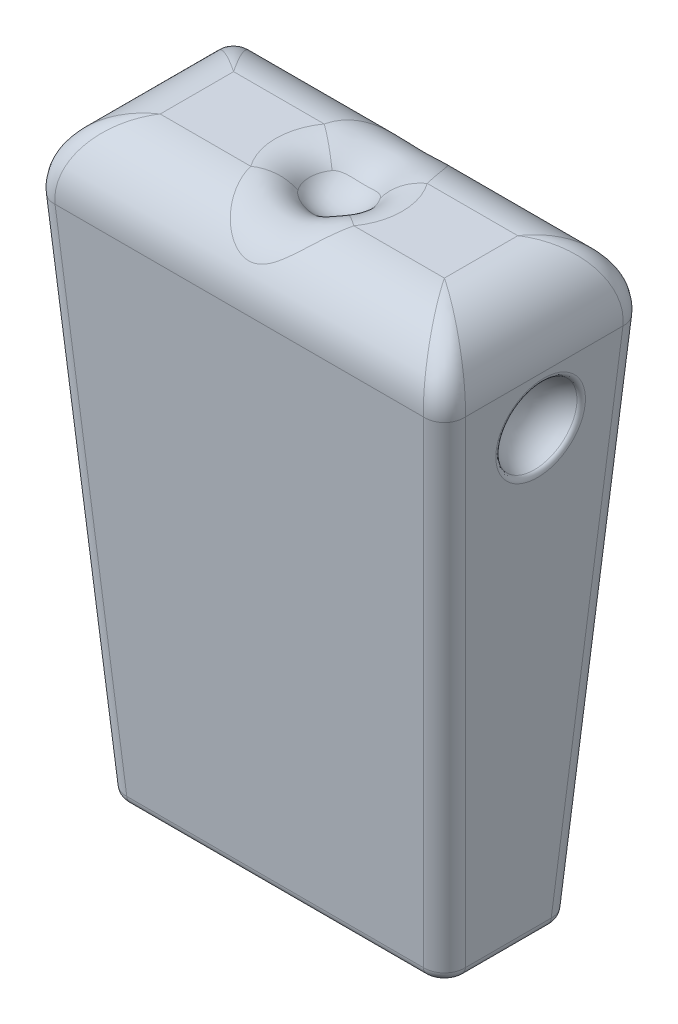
SolidWorks part; units mm, degrees
ref_plane "Front Plane" through (0, 0, 0) normal (0, 0, 1) x (1, 0, 0)
ref_plane "Top Plane" through (0, 0, 0) normal (0, 1, 0) x (1, 0, 0)
ref_plane "Right Plane" through (0, 0, 0) normal (1, 0, 0) x (0, 0, -1)
sketch "Sketch1" plane through (0, 0, 0) normal (0, 1, 0) x (1, 0, 0)
  line L1 (203.2, -76.2) -> (-203.2, -76.2)
  line L2 (203.2, -76.2) -> (203.2, 76.2)
  line L3 (203.2, 76.2) -> (-203.2, 76.2)
  line L4 (-203.2, -76.2) -> (-203.2, 76.2)
  line L5 (203.2, -76.2) -> (-203.2, 76.2) construction
  line L6 (203.2, 76.2) -> (-203.2, -76.2) construction
  point P0 (0, 0)
  dimension "D1" = 406.4
  dimension "D2" = 152.4
extrude "Boss-Extrude1" add sketch "Sketch1" along normal blind 711.2 draft 4
ref_plane "Plane1" through (0, -12.7, 0) normal (0, -1, 0) x (1, 0, 0)
sketch "Sketch2" plane through (0, -12.7, 0) normal (0, -1, 0) x (1, 0, 0)
  line L0 (-127, 57.15) -> (-127, -57.15)
  arc A0 (-127, 57.15) -> (-127, -57.15) centre (-127, 0) ccw
  dimension "D1" = 114.3
  dimension "D2" = 127
revolve "Cut-Revolve1" cut sketch "Sketch2" angle 360 about L0
mirror "Mirror1" about plane through (0, 0, 0) normal (1, 0, 0) of "Cut-Revolve1"
fillet "Fillet1" radius 25.4 4 edges at (228.066, 355.6, 101.066) (228.066, 355.6, -101.066) (-228.066, 355.6, -101.066) (-228.066, 355.6, 101.066)
fillet "Fillet2" radius 12.7 8 edges at (-195.7861, 0, 68.7861) (-203.2, 0, 0) (-195.7861, 0, -68.7861) (0, 0, -76.2) (195.7861, 0, -68.7861) (203.2, 0, 0) (195.7861, 0, 68.7861) (0, 0, 76.2)
fillet "Fillet4" radius 76.2 8 edges at (-245.518, 711.2, 118.518) (-252.9319, 711.2, 0) (-245.518, 711.2, -118.518) (0, 711.2, -125.9319) (245.518, 711.2, -118.518) (252.9319, 711.2, 0) (245.518, 711.2, 118.518) (0, 711.2, 125.9319)
ref_plane "Plane2" through (214.8803, -15.0259, 0) normal (0.9976, -0.0698, 0) x (0, 0, -1)
sketch "Sketch3" plane through (214.8803, -15.0259, 0) normal (0.9976, -0.0698, 0) x (0, 0, -1)
  line L0 (-50.8, 584.2) -> (50.8, 584.2)
  arc A0 (50.8, 584.2) -> (-50.8, 584.2) centre (0, 584.2) ccw
  dimension "D1" = 101.6
  dimension "D2" = 584.2
revolve "Cut-Revolve2" cut sketch "Sketch3" angle 360 about L0
fillet "Fillet3" radius 6.35 3 edges at (127, 0, 55.721) (-127, 0, 55.721) (246.3941, 617.704, 0)
mirror "Mirror3" about plane through (0, 0, 0) normal (1, 0, 0) of "Fillet3", "Cut-Revolve2"
ref_plane "Plane3" through (0, 717.55, 0) normal (0, 1, 0) x (-1, 0, 0)
sketch "Sketch4" plane through (0, 717.55, 0) normal (0, 1, 0) x (-1, 0, 0)
  line L0 (0, 44.45) -> (0, -44.45)
  arc A0 (0, -44.45) -> (0, 44.45) centre (0, 0) ccw
  dimension "D1" = 88.9
revolve "Cut-Revolve3" cut sketch "Sketch4" angle 360 about L0
fillet "Fillet5" radius 50.8 1 edges at (0, 711.2, 43.9941)
